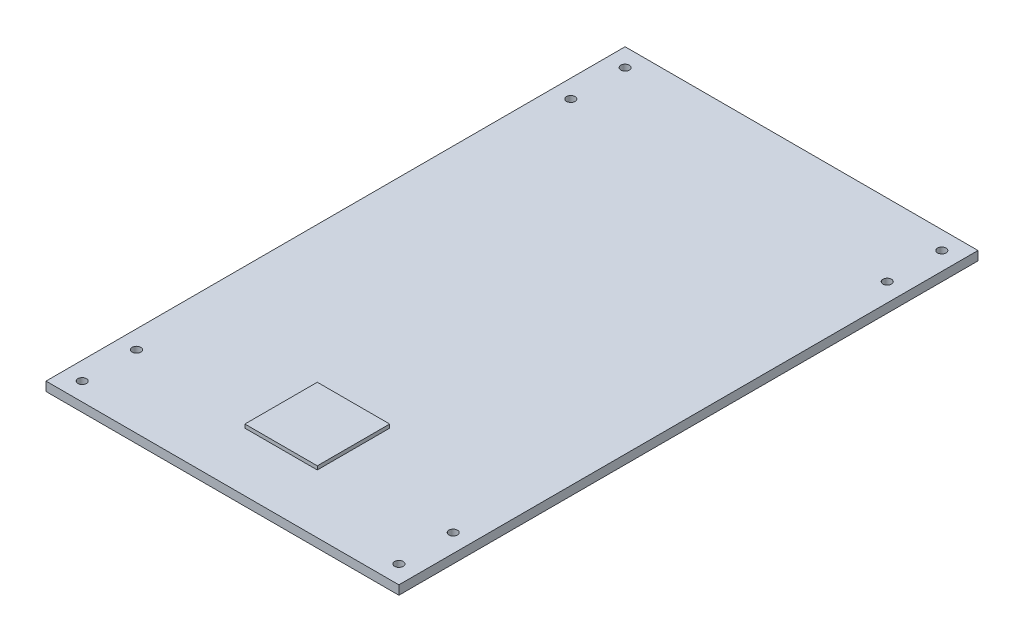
SolidWorks part; units mm, degrees
ref_plane "Front Plane" through (0, 0, 0) normal (0, 0, 1) x (1, 0, 0)
ref_plane "Top Plane" through (0, 0, 0) normal (0, 1, 0) x (1, 0, 0)
ref_plane "Right Plane" through (0, 0, 0) normal (1, 0, 0) x (0, 0, -1)
sketch "Sketch1" plane through (0, 0, 0) normal (0, 1, 0) x (1, 0, 0)
  line L1 (-61.9125, -101.6) -> (61.9125, -101.6)
  line L2 (-61.9125, -101.6) -> (-61.9125, 101.6)
  line L3 (-61.9125, 101.6) -> (61.9125, 101.6)
  line L4 (61.9125, -101.6) -> (61.9125, 101.6)
  line L5 (-61.9125, -101.6) -> (61.9125, 101.6) construction
  line L6 (-61.9125, 101.6) -> (61.9125, -101.6) construction
  point P0 (0, 0)
  dimension "D1" = 203.2
  dimension "D2" = 123.825
extrude "Boss-Extrude1" add sketch "Sketch1" along normal blind 3.175
sketch "Sketch2" plane through (0, 3.175, 0) normal (0, 1, 0) x (1, 0, 0)
  line L0 (-61.9125, 101.6) -> (-61.9125, -101.6) construction
  line L1 (-61.9125, -101.6) -> (61.9125, -101.6) construction
  line L2 (61.9125, -101.6) -> (61.9125, 101.6) construction
  line L3 (61.9125, 101.6) -> (-61.9125, 101.6) construction
  point P0 (-55.5625, -95.25)
  point P2 (-55.5625, -76.2)
  point P7 (55.5625, -95.25)
  point P9 (55.5625, -76.2)
  point P11 (-55.5625, 95.25)
  point P13 (-55.5625, 76.2)
  point P15 (55.5625, 95.25)
  point P17 (55.4582, 76.2)
  dimension "D1" = 6.35
  dimension "D2" = 19.05
  dimension "D3" = 19.05
  dimension "D4" = 6.35
  dimension "D5" = 6.35
  dimension "D6" = 6.35
  dimension "D7" = 6.35
  dimension "D8" = 6.35
  dimension "D9" = 19.05
  dimension "D10" = 6.35
  dimension "D11" = 6.35
  dimension "D12" = 19.05
  dimension "D13" = 6.35
  dimension "D14" = 6.35
hole_wizard "Ø3.0mm Dowel Hole1" positions "Sketch2" profile "Sketch3" hole size "Ø3.0" standard "ANSI Metric"
sketch "Sketch3" plane through (-55.5625, 3.175, 95.25) normal (1, 0, 0) x (0, 0, 1)
  line L0 (0, 0) -> (0, 3.175)
  line L1 (0, 3.175) -> (1.5, 3.175)
  line L2 (1.5, 3.175) -> (1.5, 0)
  line L5 (1.5, 0) -> (0, 0)
  line L11 (0, -6.35) -> (0, 107.95) construction
  dimension "Thru Hole Dia." = 3
  dimension "Thru Hole Depth" = 3.175
sketch "Sketch4" plane through (0, 3.175, 0) normal (0, 1, 0) x (1, 0, 0)
  line L1 (-12.7, -55.6225) -> (12.7, -55.6225)
  line L2 (-12.7, -55.6225) -> (-12.7, -81.0225)
  line L3 (-12.7, -81.0225) -> (12.7, -81.0225)
  line L4 (12.7, -55.6225) -> (12.7, -81.0225)
  line L5 (-12.7, -55.6225) -> (12.7, -81.0225) construction
  line L6 (-12.7, -81.0225) -> (12.7, -55.6225) construction
  point P0 (0, -68.3225)
  point P5 (0, -68.3225)
  dimension "D1" = 25.4
  dimension "D2" = 25.4
extrude "Boss-Extrude2" add sketch "Sketch4" along normal blind 1.27
